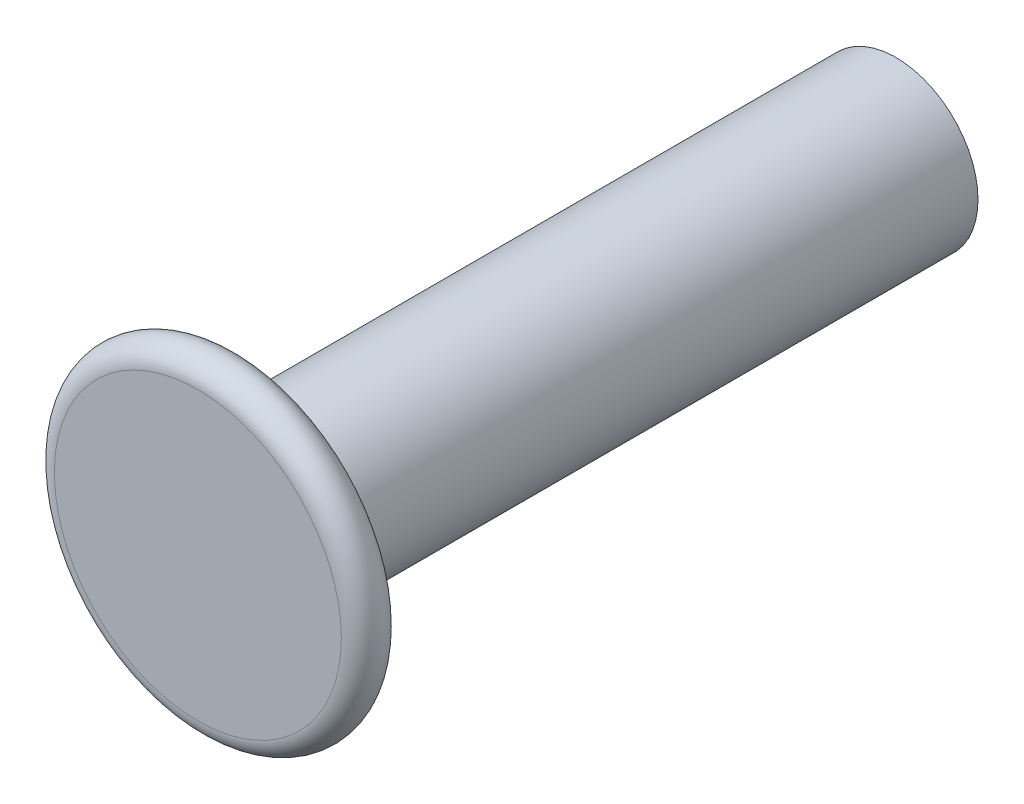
SolidWorks part; units mm, degrees
ref_plane "Front Plane" through (0, 0, 0) normal (0, 0, 1) x (1, 0, 0)
ref_plane "Top Plane" through (0, 0, 0) normal (0, 1, 0) x (1, 0, 0)
ref_plane "Right Plane" through (0, 0, 0) normal (1, 0, 0) x (0, 0, -1)
other "Configuration Table"
sketch "BaseBodySke" plane through (0, 0, 0) normal (0, 1, 0) x (1, 0, 0)
  line L0 (0, 0) -> (-5.5499, 0)
  line L1 (0, 0) -> (0, 54.1082) construction
  line L2 (0, 0) -> (0, 27.0002)
  line L3 (0, 27.0002) -> (-3.175, 27.0002)
  line L4 (-3.175, 1.6002) -> (-3.175, 27.0002)
  line L5 (-6.35, 27.0002) -> (-6.35, 1.6002) construction
  line L6 (-6.35, 0) -> (-6.35, 1.6002) construction
  line L8 (-5.5499, 1.6002) -> (-3.175, 1.6002)
  arc A0 (-5.5499, 1.6002) -> (-5.5499, 0) centre (-5.5499, 0.8001) ccw
  dimension "Diameter" = 6.35
  dimension "Head_Diameter" = 12.7
  dimension "Length" = 25.4
  dimension "Head_Depth" = 1.6002
revolve "BaseBody" add sketch "BaseBodySke" angle 360 about L1
